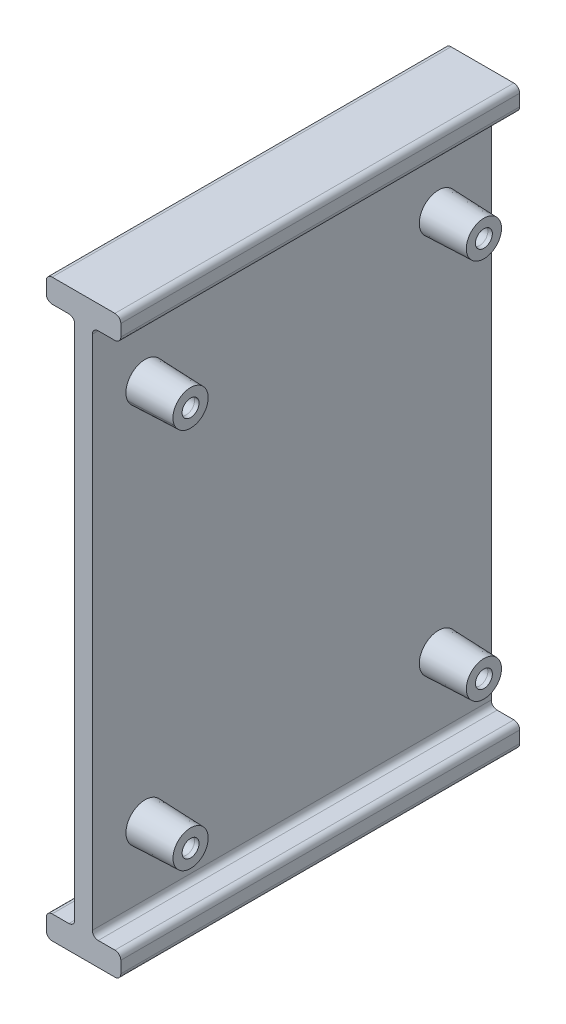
SolidWorks part; units mm, degrees
ref_plane "Front Plane" through (0, 0, 0) normal (0, 0, 1) x (1, 0, 0)
ref_plane "Top Plane" through (0, 0, 0) normal (0, 1, 0) x (1, 0, 0)
ref_plane "Right Plane" through (0, 0, 0) normal (1, 0, 0) x (0, 0, -1)
sketch "Sketch1" plane through (0, 0, 0) normal (0, 0, 1) x (1, 0, 0)
  line L0 (10.0952, 0) -> (-7.0952, 0)
  line L2 (-1.5, -44) -> (-1.5, 44)
  line L4 (1.5, -44) -> (1.5, 44)
  line L5 (-1.5, -45) -> (1.5, 45) construction
  line L6 (-1.5, 45) -> (1.5, -45) construction
  line L7 (-5.35, -49) -> (5.35, -49)
  line L8 (-6.35, -48) -> (-6.35, -46)
  line L10 (6.35, -48) -> (6.35, -46)
  line L11 (-6.35, -49) -> (6.35, -45) construction
  line L12 (-6.35, -45) -> (6.35, -49) construction
  line L14 (6.35, 48) -> (6.35, 46)
  line L15 (-5.35, 49) -> (5.35, 49)
  line L16 (-6.35, 48) -> (-6.35, 46)
  line L17 (-5.35, -45) -> (-2.5, -45)
  line L18 (2.5, -45) -> (5.35, -45)
  line L19 (-5.35, 45) -> (-2.5, 45)
  line L20 (2.5, 45) -> (5.35, 45)
  arc A0 (-5.35, 45) -> (-6.35, 46) centre (-5.35, 46) cw
  arc A1 (-5.35, 49) -> (-6.35, 48) centre (-5.35, 48) ccw
  arc A2 (6.35, 48) -> (5.35, 49) centre (5.35, 48) ccw
  arc A3 (5.35, 45) -> (6.35, 46) centre (5.35, 46) ccw
  arc A4 (2.5, 45) -> (1.5, 44) centre (2.5, 44) ccw
  arc A5 (-1.5, 44) -> (-2.5, 45) centre (-2.5, 44) ccw
  arc A6 (2.5, -45) -> (1.5, -44) centre (2.5, -44) cw
  arc A7 (5.35, -45) -> (6.35, -46) centre (5.35, -46) cw
  arc A8 (5.35, -49) -> (6.35, -48) centre (5.35, -48) ccw
  arc A9 (-2.5, -45) -> (-1.5, -44) centre (-2.5, -44) ccw
  arc A10 (-6.35, -46) -> (-5.35, -45) centre (-5.35, -46) cw
  arc A11 (-5.35, -49) -> (-6.35, -48) centre (-5.35, -48) cw
  point P0 (0, 0)
  point P6 (0, -47)
  point P15 (1.5, 0)
  point P20 (-6.35, 45)
  point P23 (-6.35, 49)
  point P26 (6.35, 49)
  point P29 (6.35, 45)
  dimension "D5" = 1
  dimension "D1" = 3
  dimension "D2" = 90
  dimension "D3" = 4
  dimension "D4" = 12.7
extrude "Boss-Extrude1" add sketch "Sketch1" along normal mid plane 68 contours L18 L4 L0 L2 L17 L8 L7 L10 | L4 L20 L14 L15 L16 L19 L2 L0
sketch "Sketch3" plane through (1.5, 0, 0) normal (1, 0, 0) x (0, 0, -1)
  line L0 (0, 8.5778) -> (0, -8.5778) construction
  line L1 (8.5778, 0) -> (-8.5778, 0) construction
  point P0 (-25, 32.5)
  point P3 (25, 32.5)
  point P7 (25, -32.5)
  point P8 (-25, -32.5)
  dimension "MountLength" = 50
  dimension "MountWidth" = 65
sketch3d "3DSketch1"
  point P0 (1.5, 32.5036, 25.0016)
other "Mounting Boss1" parameters "BossHeight"=8, "BossDiam"=6, "StepHeight"=1, "StepDia"=2.9, "HoleDiam"=2.9, "CBoreDiam"=0, "CBoreDepth"=0, "HoleDepth"=7, "D9"=0, "D10"=0, "Clearance"=0.254, "FinLength"=6, "FinWidth"=1, "FinHeight"=8, "ChamferDist"=2.4, "BossDraft"=2, "HoleDraft"=1, "StepDraft"=1.5, "D19"=0, "FinDraft"=1, "ChamferAngle"=60
pattern_sketch "Sketch-Pattern3" of "Mounting Boss1"
